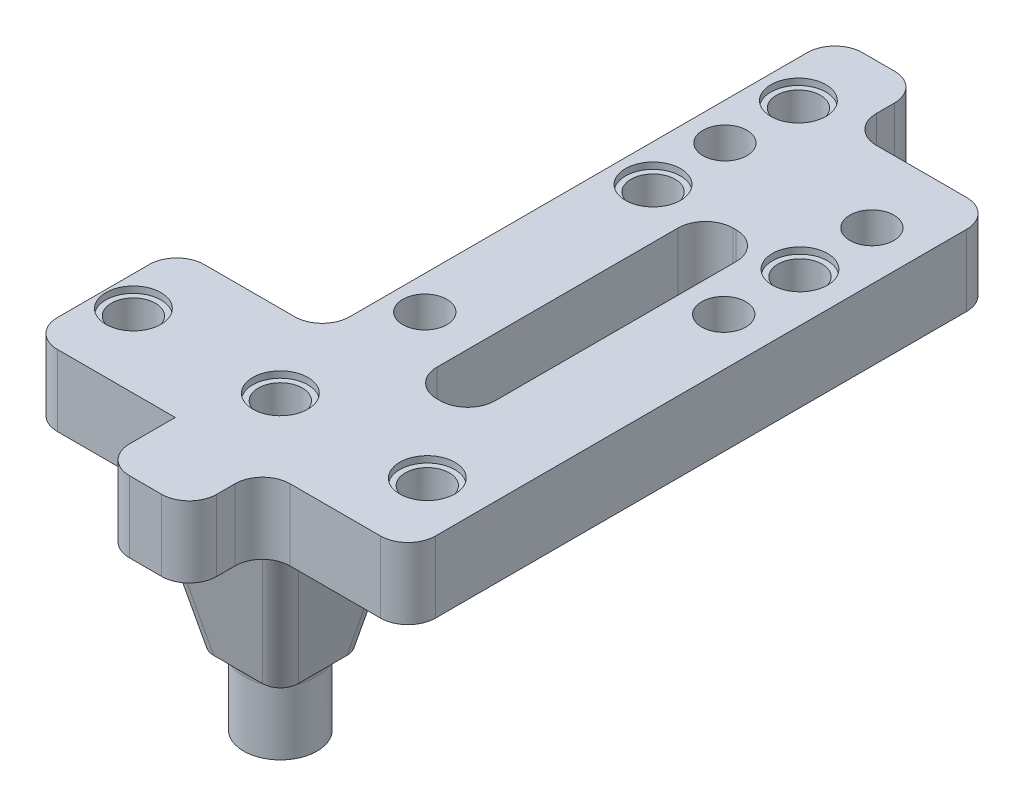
SolidWorks part; units mm, degrees
ref_plane "Front Plane" through (0, 0, 0) normal (0, 0, 1) x (1, 0, 0)
ref_plane "Top Plane" through (0, 0, 0) normal (0, 1, 0) x (1, 0, 0)
ref_plane "Right Plane" through (0, 0, 0) normal (1, 0, 0) x (0, 0, -1)
sketch "Sketch1" plane through (0, 0, 0) normal (0, 1, 0) x (1, 0, 0)
  line L0 (0, 0) -> (15.841, 0)
  line L1 (15.841, 0) -> (15.841, -7.985)
  line L2 (15.841, -7.985) -> (25.341, -7.985)
  line L3 (25.341, -7.985) -> (25.341, 0)
  line L4 (25.341, 0) -> (41.182, 0)
  line L5 (41.182, 0) -> (41.182, 63.83)
  line L6 (41.182, 63.83) -> (25.341, 63.83)
  line L7 (25.341, 63.83) -> (25.341, 71.815)
  line L8 (25.341, 71.815) -> (15.841, 71.815)
  line L9 (15.841, 71.815) -> (15.841, 16)
  line L10 (15.841, 16) -> (0, 16)
  line L11 (0, 16) -> (0, 0)
  dimension "D1" = 16
  dimension "D2" = 9.5
  dimension "D3" = 9.5
  dimension "D4" = 7.985
  dimension "D5" = 15.841
  dimension "D6" = 79.8
  dimension "D7" = 63.83
  dimension "D8" = 15.841
extrude "Boss-Extrude1" add sketch "Sketch1" along normal blind 7.75
sketch "Sketch2" plane through (0, 7.75, 0) normal (0, 1, 0) x (1, 0, 0)
  line L0 (25.341, 48.23) -> (31.681, 48.23)
  line L1 (31.681, 48.23) -> (31.681, 16)
  line L2 (31.681, 16) -> (25.341, 16)
  line L3 (25.341, 48.23) -> (25.341, 16)
  line L4 (15.841, 71.815) -> (15.841, 16) construction
  line L5 (25.341, 0) -> (41.182, 0) construction
  dimension "D1" = 6.34
  dimension "D2" = 9.5
  dimension "D3" = 32.23
  dimension "D4" = 16
extrude "Cut-Extrude1" cut sketch "Sketch2" against normal through all
sketch "Sketch3" plane through (0, 7.75, 0) normal (0, 1, 0) x (-1, 0, 0)
  line L0 (0, -8) -> (-44.5338, -8) construction
  line L1 (0, -16) -> (0, 0) construction
  line L2 (-9.8115, -55.81) -> (-51.1673, -55.81) construction
  line L3 (0, 0) -> (-15.841, 0) construction
  line L4 (-35.282, -72.908) -> (-35.282, 6.0722) construction
  line L5 (-41.182, 0) -> (-41.182, -63.83) construction
  line L6 (-19.282, -5.6) -> (-19.282, -75.0846) construction
  circle A0 centre (-3.282, -8) radius 2.4
  circle A1 centre (-35.282, -8) radius 2.4
  circle A2 centre (-19.282, -8) radius 2.4
  circle A3 centre (-19.882, -55.81) radius 2.4
  circle A4 centre (-35.882, -55.81) radius 2.4
  dimension "D4" = 16
  dimension "D5" = 16
  dimension "D6" = 0.6
  dimension "D7" = 16
  dimension "D8" = 4.8
  dimension "D9" = 4.8
  dimension "D1" = 8
  dimension "D2" = 47.81
  dimension "D3" = 5.9
extrude "Cut-Extrude2" cut sketch "Sketch3" against normal through all
sketch "Sketch4" plane through (0, 7.75, 0) normal (0, 1, 0) x (-1, 0, 0)
  circle A2 centre (-35.282, -8) radius 3
  circle A3 centre (-19.282, -8) radius 3
  circle A4 centre (-3.282, -8) radius 3
extrude "Cut-Extrude3" cut sketch "Sketch4" against normal blind 0.7
sketch "Sketch5" plane through (0, 0, 0) normal (0, -1, 0) x (1, 0, 0)
  circle A0 centre (3.282, -8) radius 3
  circle A1 centre (19.282, -8) radius 3
  circle A2 centre (35.282, -8) radius 3
extrude "Cut-Extrude4" cut sketch "Sketch5" against normal blind 0.7
fillet "Fillet2" radius 3 15 edges at (41.182, 3.875, 0) (41.182, 3.875, -63.83) (25.341, 3.875, -63.83) (31.681, 3.875, -48.23) (25.341, 3.875, -48.23) (25.341, 3.875, -16) (25.341, 3.875, 0) (25.341, 3.875, 7.985) (15.841, 3.875, 7.985) (0, 3.875, 0) (0, 3.875, -16) (15.841, 3.875, -16) (31.681, 3.875, -16) (25.341, 3.875, -71.815) (15.841, 3.875, -71.815)
sketch "Sketch6" plane through (0, 7.75, 0) normal (0, 1, 0) x (1, 0, 0)
  line L0 (7.3084, 23.53) -> (28.9619, 23.53) construction
  line L1 (0, 8) -> (44.5338, 8) construction
  line L2 (19.282, 5.6) -> (19.282, 75.0846) construction
  circle A0 centre (19.482, 23.53) radius 2.4
  dimension "D2" = 4.8
  dimension "D1" = 15.53
  dimension "D3" = 0.2
extrude "Cut-Extrude5" cut sketch "Sketch6" against normal through all
sketch "Sketch7" plane through (0, 7.75, 0) normal (0, 1, 0) x (-1, 0, 0)
  line L0 (-28.5559, -39.58) -> (-45.9787, -39.58) construction
  line L1 (-9.8115, -55.81) -> (-51.1673, -55.81) construction
  line L2 (-35.282, -72.908) -> (-35.282, 6.0722) construction
  circle A0 centre (-35.982, -39.58) radius 2.4
  dimension "D2" = 4.8
  dimension "D1" = 16.23
  dimension "D3" = 0.7
extrude "Cut-Extrude6" cut sketch "Sketch7" against normal through all
sketch "Sketch8" plane through (0, 7.75, 0) normal (0, 1, 0) x (-1, 0, 0)
  line L0 (-11.6605, -47.98) -> (-48.1562, -47.98) construction
  line L1 (-11.6605, -63.81) -> (-52.5357, -63.81) construction
  line L2 (-19.882, -68.7534) -> (-19.882, -42.3047) construction
  line L3 (-15.841, -68.815) -> (-15.841, -19) construction
  circle A0 centre (-19.882, -55.81) radius 2.4 construction
  circle A1 centre (-19.882, -47.98) radius 2.4
  circle A2 centre (-19.882, -63.81) radius 2.4
  circle A3 centre (-35.882, -47.98) radius 2.4
  dimension "D2" = 7.83
  dimension "D3" = 4.8
  dimension "D4" = 4.8
  dimension "D5" = 4.8
  dimension "D6" = 16
  dimension "D7" = 4.041
  dimension "D1" = 15.83
extrude "Cut-Extrude7" cut sketch "Sketch8" against normal through all
sketch "Sketch9" plane through (0, 7.75, 0) normal (0, 1, 0) x (-1, 0, 0)
  circle A0 centre (-19.882, -63.81) radius 3
  circle A1 centre (-19.882, -47.98) radius 3
  circle A2 centre (-35.882, -47.98) radius 3
  dimension "D1" = 6
  dimension "D2" = 6
  dimension "D3" = 6
extrude "Cut-Extrude8" cut sketch "Sketch9" against normal blind 0.7
sketch "Sketch10" plane through (0, 0, 0) normal (0, -1, 0) x (1, 0, 0)
  circle A0 centre (19.882, -63.81) radius 3
  circle A1 centre (19.882, -47.98) radius 3
  circle A2 centre (35.882, -47.98) radius 3
  dimension "D1" = 6
  dimension "D2" = 6
  dimension "D3" = 6
extrude "Cut-Extrude9" cut sketch "Sketch10" against normal blind 0.7
sketch "Sketch14" plane through (0, 0, 0) normal (0, -1, 0) x (1, 0, 0)
  line L1 (11.282, 0) -> (27.282, 0)
  line L2 (11.282, 0) -> (11.282, -16)
  line L3 (11.282, -16) -> (27.282, -16)
  line L4 (27.282, 0) -> (27.282, -16)
  line L5 (11.282, 0) -> (27.282, -16) construction
  line L6 (11.282, -16) -> (27.282, 0) construction
  point P0 (19.282, -8)
  dimension "D1" = 16
  dimension "D2" = 16
extrude "Boss-Extrude5" add sketch "Sketch14" along normal blind 16 draft 12
sketch "Sketch15" plane through (0, -16, 0) normal (0, -1, 0) x (1, 0, 0)
  circle A0 centre (19.282, -8) radius 4
  circle A1 centre (19.282, -8) radius 3 construction
  dimension "D1" = 8
extrude "Boss-Extrude6" add sketch "Sketch15" along normal blind 8
sketch "Sketch16" plane through (0, 7.75, 0) normal (0, 1, 0) x (1, 0, 0)
  circle A0 centre (19.282, 8) radius 2.4
  dimension "D1" = 4.8
extrude "Cut-Extrude11" cut sketch "Sketch16" against normal through all
fillet "Fillet7" radius 1 1 edges at (19.282, -16, -12)
fillet "Fillet8" radius 2 4 edges at (25.5815, -8, -1.7005) (12.9825, -8, -1.7005) (25.5815, -8, -14.2995) (12.9825, -8, -14.2995)
